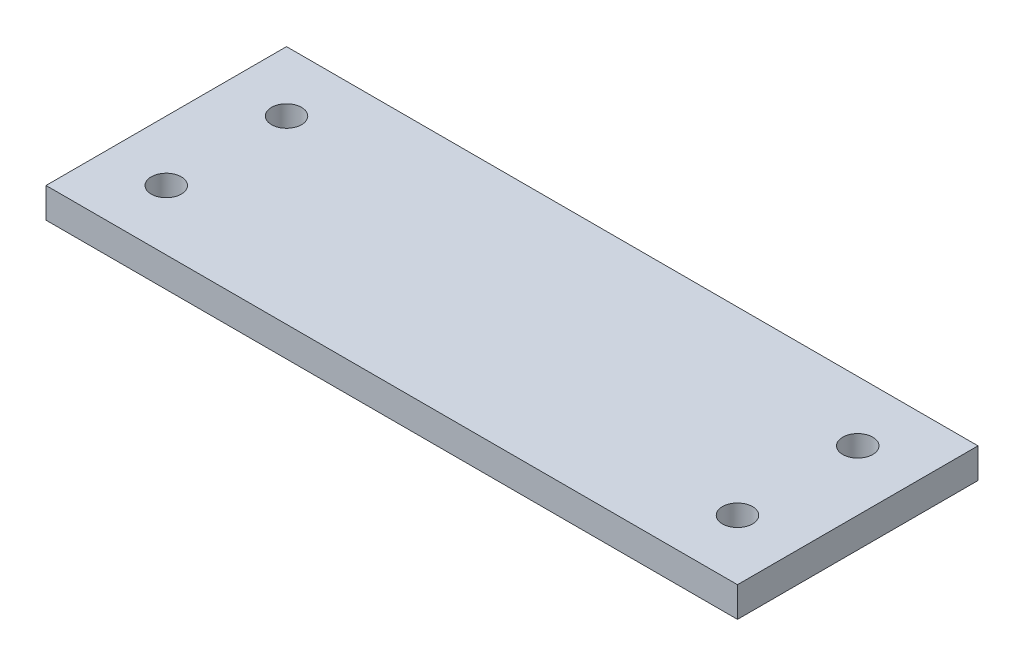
SolidWorks part; units mm, degrees
ref_plane "Front Plane" through (0, 0, 0) normal (0, 0, 1) x (1, 0, 0)
ref_plane "Top Plane" through (0, 0, 0) normal (0, 1, 0) x (1, 0, 0)
ref_plane "Right Plane" through (0, 0, 0) normal (1, 0, 0) x (0, 0, -1)
sketch "Sketch1" plane through (0, 0, 0) normal (0, 1, 0) x (1, 0, 0)
  line L0 (115, 20) -> (0, 20) construction
  line L1 (0, 0) -> (115, 0)
  line L2 (0, 0) -> (0, 40)
  line L3 (0, 40) -> (115, 40)
  line L4 (115, 0) -> (115, 40)
  line L5 (57.5, 40) -> (57.5, 0) construction
  circle A0 centre (10, 30) radius 2.5
  circle A1 centre (10, 10) radius 2.5
  circle A2 centre (105, 10) radius 2.5
  circle A3 centre (105, 30) radius 2.5
  dimension "D3" = 5
  dimension "D1" = 115
  dimension "D2" = 40
  dimension "D4" = 10
  dimension "D5" = 10
extrude "Boss-Extrude1" add sketch "Sketch1" along normal blind 5 contours L3 L4 L1 L2
